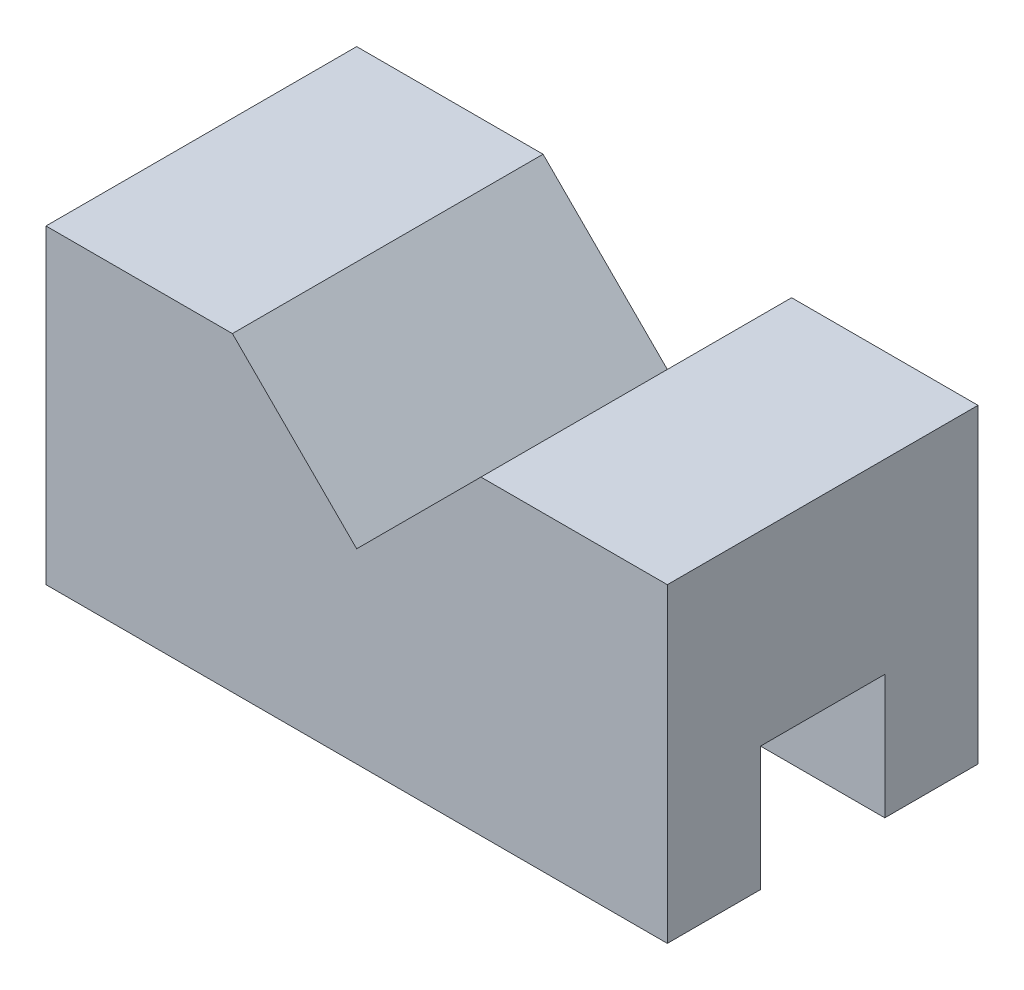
SolidWorks part; units mm, degrees
ref_plane "正面" through (0, 0, 0) normal (0, 0, 1) x (1, 0, 0)
ref_plane "平面" through (0, 0, 0) normal (0, 1, 0) x (1, 0, 0)
ref_plane "右側面" through (0, 0, 0) normal (1, 0, 0) x (0, 0, -1)
sketch "ｽｹｯﾁ1" plane through (0, 0, 0) normal (0, 0, 1) x (1, 0, 0)
  line L0 (-20, 50) -> (0, 30)
  line L1 (-50, 0) -> (50, 0)
  line L2 (-50, 0) -> (-50, 50)
  line L3 (-50, 50) -> (-20, 50)
  line L4 (50, 0) -> (50, 50)
  line L5 (0, 30) -> (20, 50)
  line L6 (20, 50) -> (50, 50)
  dimension "D1" = 50
  dimension "D2" = 100
  dimension "D3" = 20
  dimension "D4" = 20
  dimension "D5" = 90
extrude "押し出し1" add sketch "ｽｹｯﾁ1" against normal mid plane 50
sketch "ｽｹｯﾁ2" plane through (50, 0, 0) normal (1, 0, 0) x (0, 0, -1)
  line L0 (25, 0) -> (-25, 0) construction
  line L1 (-10, 0) -> (10, 0)
  line L2 (-10, 0) -> (-10, 20)
  line L3 (-10, 20) -> (10, 20)
  line L4 (10, 0) -> (10, 20)
  dimension "D1" = 20
  dimension "D2" = 20
extrude "ｶｯﾄ - 押し出し1" cut sketch "ｽｹｯﾁ2" against normal through all
